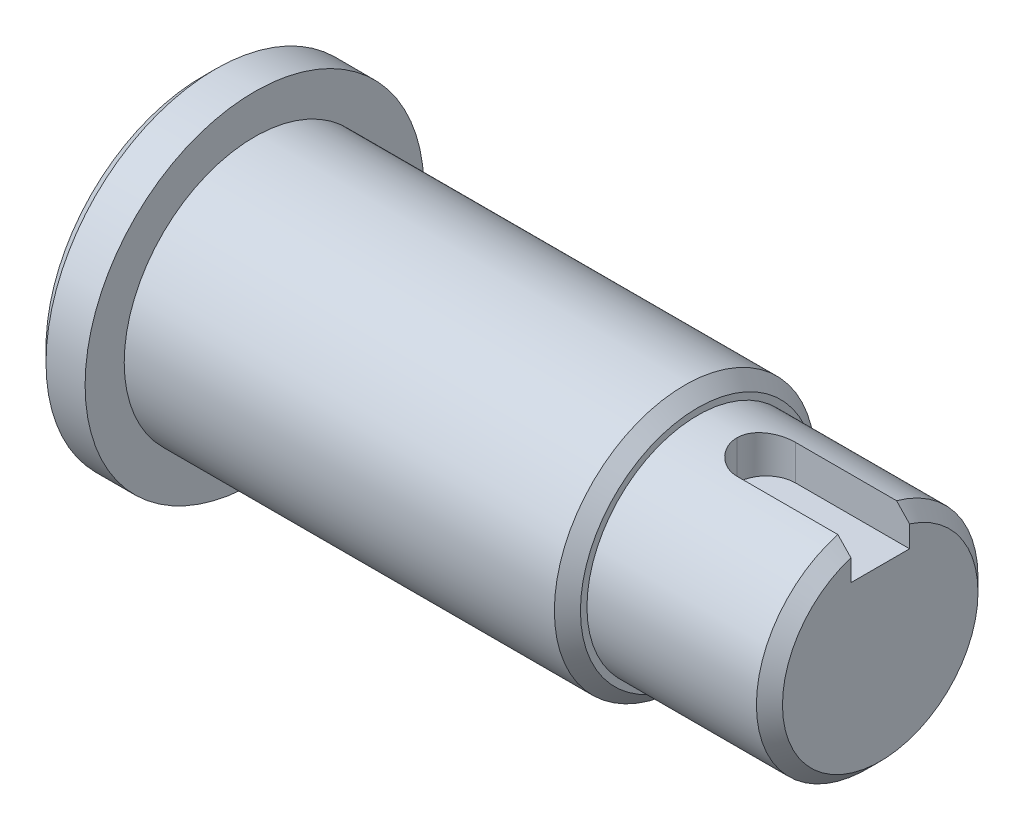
SolidWorks part; units mm, degrees
ref_plane "Face" through (0, 0, 0) normal (0, 0, 1) x (1, 0, 0)
ref_plane "Dessus" through (0, 0, 0) normal (0, 1, 0) x (1, 0, 0)
ref_plane "Droite" through (0, 0, 0) normal (1, 0, 0) x (0, 0, -1)
sketch "Esquisse1" plane through (0, 0, 0) normal (0, 0, 1) x (1, 0, 0)
  line L0 (0, 0) -> (53.8138, 0) construction
  line L1 (0, 0) -> (0, 13)
  line L2 (4, 10) -> (38, 10)
  line L3 (38, 10) -> (38, 8.5)
  line L4 (38, 8.5) -> (52, 8.5)
  line L5 (52, 8.5) -> (52, 0)
  line L6 (52, 0) -> (0, 0)
  line L7 (4, 10) -> (4, 13)
  line L8 (4, 13) -> (0, 13)
  dimension "D1" = 17
  dimension "D2" = 20
  dimension "D3" = 52
  dimension "D4" = 26
  dimension "D5" = 4
  dimension "D6" = 34
revolve "Révolution1" add sketch "Esquisse1" angle 360 about L0
chamfer "Chanfrein1" distance 1 angle 45 1 edges at (0, 0, 13)
chamfer "Chanfrein2" distance 1 angle 45 1 edges at (52, 0, 8.5)
sketch "Esquisse2" plane through (52, 0, 0) normal (1, 0, 0) x (0, 0, -1)
  line L1 (-2.25, 10) -> (2.25, 10)
  line L2 (-2.25, 10) -> (-2.25, 5.5)
  line L3 (-2.25, 5.5) -> (2.25, 5.5)
  line L4 (2.25, 10) -> (2.25, 5.5)
  dimension "D1" = 4.5
  dimension "D2" = 2.25
  dimension "D3" = 10
  dimension "D4" = 5.5
extrude "Enlèv. mat.-Extru.1" cut sketch "Esquisse2" against normal blind 11
fillet "Congé1" radius 2.25 2 edges at (41, 6.8484, 2.25) (41, 6.8484, -2.25)
chamfer "Chanfrein3" distance 1 angle 45 1 edges at (38, 0, 10)
